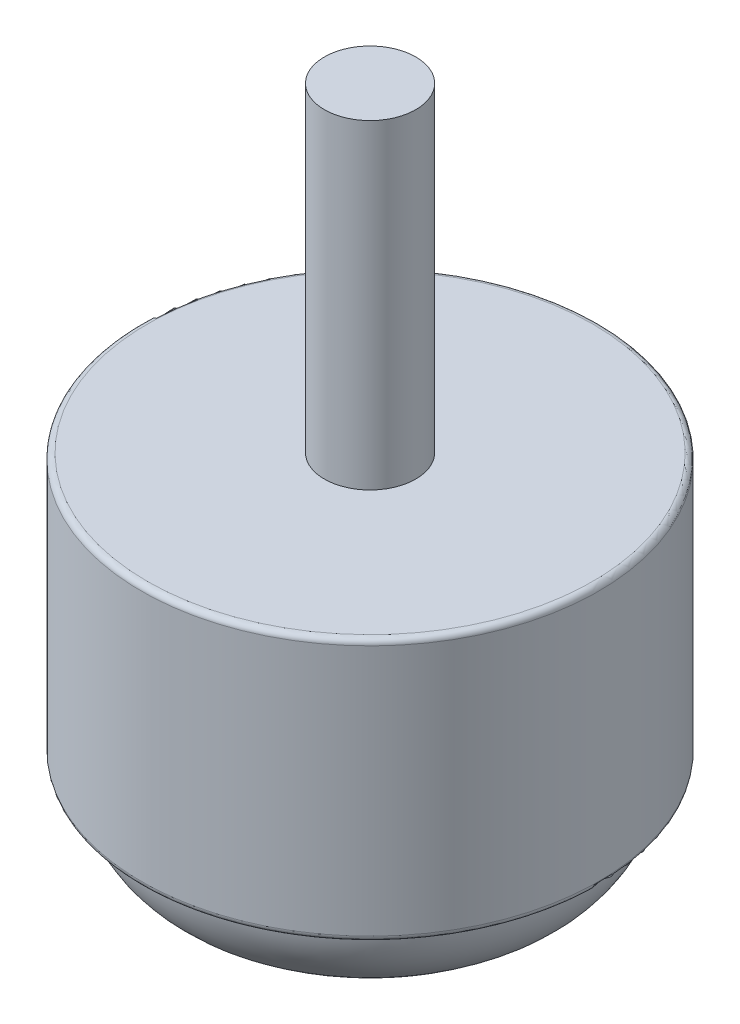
SolidWorks part; units mm, degrees
ref_plane "Plan de face" through (0, 0, 0) normal (0, 0, 1) x (1, 0, 0)
ref_plane "Plan de dessus" through (0, 0, 0) normal (0, 1, 0) x (1, 0, 0)
ref_plane "Plan de droite" through (0, 0, 0) normal (1, 0, 0) x (0, 0, -1)
sketch "Esquisse1" plane through (0, 0, 0) normal (0, 0, 1) x (1, 0, 0)
  line L0 (0, 0) -> (0, 64) construction
  line L1 (0, 64) -> (4, 64)
  line L2 (4, 64) -> (4, 36)
  line L3 (4, 36) -> (19.5, 36)
  line L4 (20, 35.5) -> (20, 13.5)
  line L5 (19.5, 13) -> (19.1745, 13)
  line L6 (13.4231, 6) -> (10.6771, 6)
  line L7 (0, 64) -> (0, 0)
  arc A0 (18.1808, 12.1124) -> (13.6152, 6.0384) centre (10.7378, 12.9542) cw
  arc A1 (0, 0) -> (10.6771, 6) centre (0, 12.5) ccw
  arc A2 (19.1745, 13) -> (18.1808, 12.1124) centre (19.1745, 12) ccw
  arc A3 (20, 13.5) -> (19.5, 13) centre (19.5, 13.5) cw
  arc A4 (13.4231, 6) -> (13.6152, 6.0384) centre (13.4231, 6.5) ccw
  arc A5 (20, 35.5) -> (19.5, 36) centre (19.5, 35.5) ccw
  dimension "D5" = 12.5
  dimension "D8" = 1
  dimension "D9" = 0.5
  dimension "D1" = 64
  dimension "D2" = 8
  dimension "D3" = 28
  dimension "D4" = 40
  dimension "D6" = 6
  dimension "D7" = 23
revolve "Révolution1" add sketch "Esquisse1" angle 360 about L0
